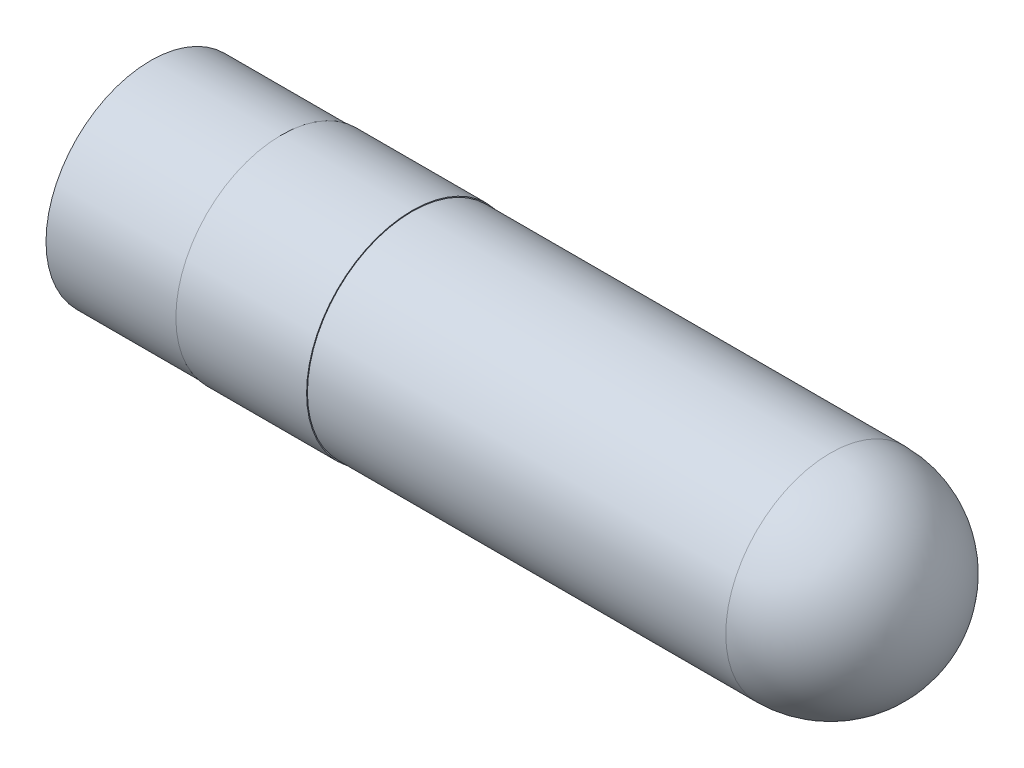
SolidWorks part; units mm, degrees
ref_plane "Front" through (0, 0, 0) normal (0, 0, 1) x (1, 0, 0)
ref_plane "Top" through (0, 0, 0) normal (0, 1, 0) x (1, 0, 0)
ref_plane "Right" through (0, 0, 0) normal (1, 0, 0) x (0, 0, -1)
sketch "Esquisse1" plane through (0, 0, 0) normal (0, 0, 1) x (1, 0, 0)
  line L0 (50, 0) -> (-50, 0) construction
  line L1 (0, 12) -> (-78, 12)
  line L2 (-78, 12) -> (-78, 10.8)
  line L3 (-78, 10.8) -> (0, 10.8)
  line L4 (0, -50) -> (0, 50) construction
  line L5 (10.8, 0) -> (12, 0)
  line L6 (-56.5203, 0) -> (28.6457, 0) construction
  arc A0 (12, 0) -> (0, 12) centre (0, 0) ccw
  arc A1 (0, 10.8) -> (10.8, 0) centre (0, 0) cw
  dimension "D1" = 90
  dimension "D2" = 10.8
  dimension "D3" = 12
revolve "Révolution1" add sketch "Esquisse1" angle 360 about L6
sketch "Esquisse2" plane through (0, 0, 0) normal (0, 0, 1) x (1, 0, 0)
  line L0 (-88.6544, 0) -> (-24.5895, 0) construction
  line L1 (-63, 12.1) -> (-48, 12.1)
  line L2 (-63, 12.1) -> (-63, 12)
  line L3 (-63, 12) -> (-48, 12)
  line L4 (-48, 12.1) -> (-48, 12)
  line L5 (50, 0) -> (-50, 0) construction
  line L6 (-78, 12) -> (-78, -12) construction
  dimension "D1" = 24
  dimension "D2" = 0.1
  dimension "D3" = 15
  dimension "D4" = 15
revolve "Révolution2" add sketch "Esquisse2" angle 360 about L0
